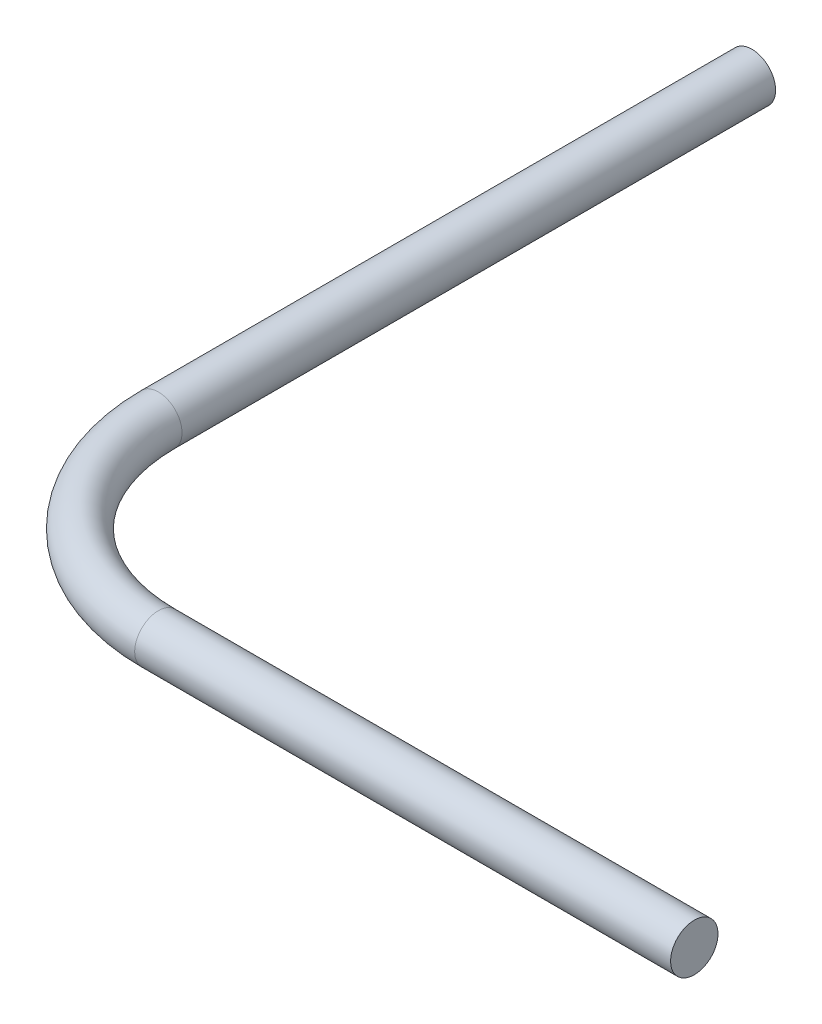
SolidWorks part; units mm, degrees
ref_plane "Plan de face" through (0, 0, 0) normal (0, 0, 1) x (1, 0, 0)
ref_plane "Plan de dessus" through (0, 0, 0) normal (0, 1, 0) x (1, 0, 0)
ref_plane "Plan de droite" through (0, 0, 0) normal (1, 0, 0) x (0, 0, -1)
sketch "Esquisse1" plane through (0, 0, 0) normal (0, 0, 1) x (1, 0, 0)
  circle A0 centre (-6.25, -8.25) radius 0.25
  dimension "D1" = 0.5
ref_plane "Plan1" through (0, -8.25, 0) normal (0, 1, 0) x (-1, 0, 0)
sketch "Esquisse2" plane through (0, -8.25, 0) normal (0, 1, 0) x (-1, 0, 0)
  line L0 (6.25, 0) -> (6.25, 6.2658)
  line L1 (4.25, 8.2658) -> (-1.4073, 8.2658)
  line L2 (-1.4106, 7.9658) -> (-1.4041, 8.5658) construction
  arc A0 (6.25, 6.2658) -> (4.25, 8.2658) centre (4.25, 6.2658) ccw
  dimension "D1" = 2
sweep "Balayage1" add profiles "Esquisse1" path "Esquisse2"
